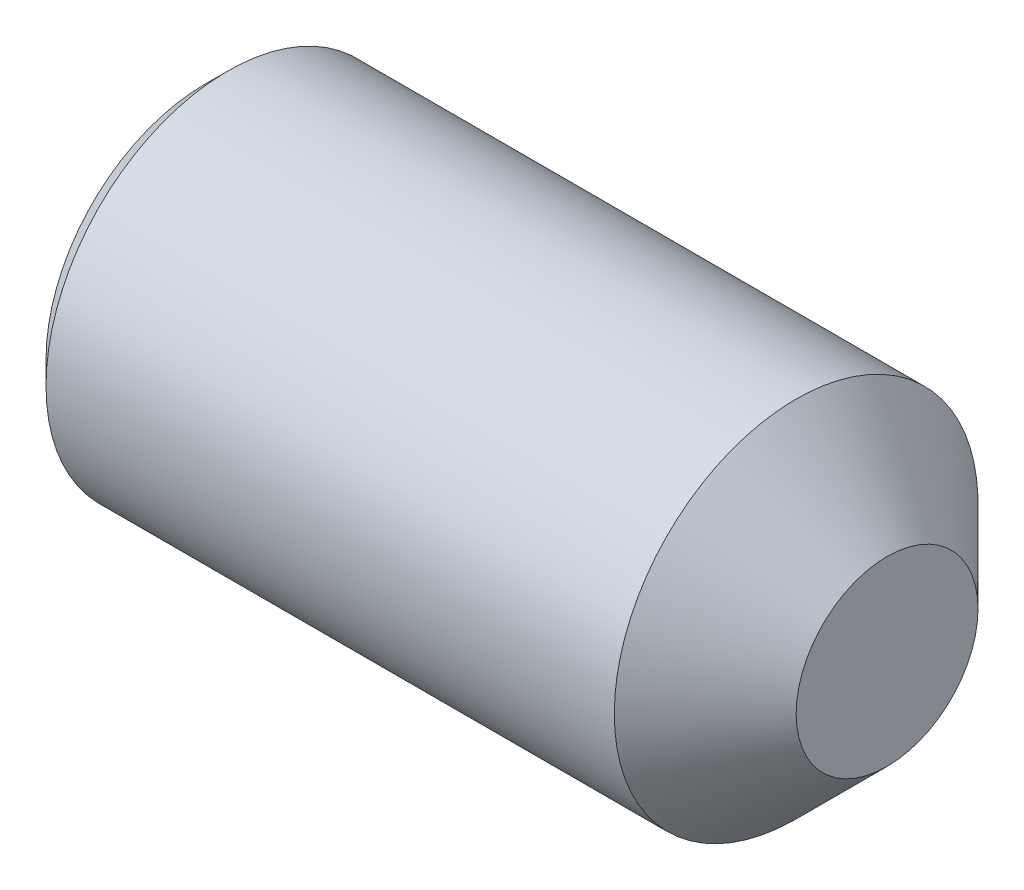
SolidWorks part; units mm, degrees
ref_plane "Front" through (0, 0, 0) normal (0, 0, 1) x (1, 0, 0)
ref_plane "Top" through (0, 0, 0) normal (0, 1, 0) x (1, 0, 0)
ref_plane "Right" through (0, 0, 0) normal (1, 0, 0) x (0, 0, -1)
sketch "Sketch1" plane through (0, 0, 0) normal (0, 0, 1) x (1, 0, 0)
  line L0 (0, 0) -> (3, 0)
  line L1 (3, 0) -> (3, 0.4)
  line L2 (3, 0.4) -> (2.6, 0.8)
  line L3 (2.6, 0.8) -> (0.1, 0.8)
  line L4 (0.1, 0.8) -> (0, 0.7)
  line L5 (0, 0.7) -> (0, 0)
  line L6 (-10.745, 0) -> (0.8952, 0) construction
  dimension "D1" = 45
  dimension "l" = 3
  dimension "D2" = 45
  dimension "dp" = 0.8
  dimension "d" = 1.6
  dimension "df" = 1.4
revolve "Base" add sketch "Sketch1" angle 360 about L6
sketch "Sketch2" plane through (0, -0.0219, 0.0101) normal (-1, 0, 0) x (0, 0, 1)
  line L1 (0.394, 0.0219) -> (0.1919, 0.3719)
  line L2 (0.1919, 0.3719) -> (-0.2122, 0.3719)
  line L3 (-0.2122, 0.3719) -> (-0.4143, 0.0219)
  line L4 (-0.4143, 0.0219) -> (-0.2122, -0.3281)
  line L5 (-0.2122, -0.3281) -> (0.1919, -0.3281)
  line L6 (0.1919, -0.3281) -> (0.394, 0.0219)
  circle A0 centre (-0.0101, 0.0219) radius 0.35 construction
  dimension "s" = 0.7
extrude "HexagonSocket" cut sketch "Sketch2" against normal blind 0.7
sketch "Sketch3" plane through (0, 0, 0) normal (0, 0, 1) x (1, 0, 0)
  line L0 (-3.1441, 0) -> (0.1622, 0) construction
  line L2 (0.7, 0.35) -> (0.9021, 0)
  line L4 (0.7, 0.35) -> (0.7, 0)
  line L5 (0.7, 0) -> (0.9021, 0)
  dimension "D1" = 60
revolve "Cut-Revolve1" cut sketch "Sketch3" angle 360 about L0
sketch "Sketch4" plane through (0, 0, 0) normal (0, 0, 1) x (1, 0, 0)
  line L0 (0.1, 0.7134) -> (0.15, 0.8)
  line L1 (0.15, 0.8) -> (0.15, 0.9)
  line L2 (0.15, 0.9) -> (0.05, 0.9)
  line L3 (0.05, 0.9) -> (0.05, 0.8)
  line L4 (0.05, 0.8) -> (0.1, 0.7134)
  line L5 (0, 0) -> (0.9616, 0) construction
  line L6 (0.1, 0.8) -> (0.1, -0.8) construction
  dimension "D1" = 1.6
  dimension "D2" = 0.1
revolve "Cut-Revolve10" [suppressed] cut sketch "Sketch4" angle 360 about L5
pattern_linear "LPattern10" [suppressed] count 24 spacing 0.12 along (1, 0, 0)
equation "\"df@Sketch1\" = \"D2@ThreadCosmetic1\""
equation "\"D1@Sketch4\" = \"d@Sketch1\""
equation "\"D2@Sketch4\" =  ( \"d@Sketch1\" - \"D2@ThreadCosmetic1\" )  / 2"
equation "\"D3@LPattern10\" = \"D2@Sketch4\" * 1.2"
equation "\"D1@LPattern10\" = (  \"l@Sketch1\" -  ( \"d@Sketch1\" - \"df@Sketch1\" )  / 2 )  / \"D3@LPattern10\""
